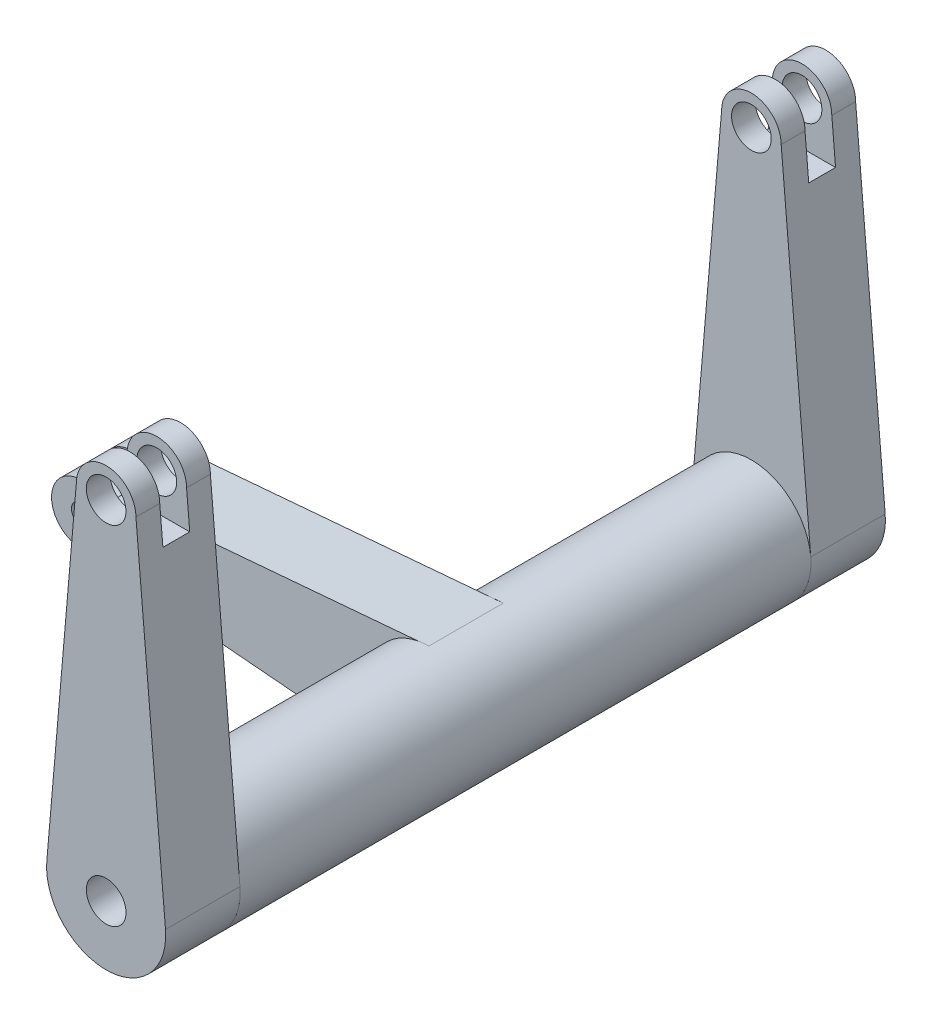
SolidWorks part; units mm, degrees
ref_plane "Front Plane" through (0, 0, 0) normal (0, 0, 1) x (1, 0, 0)
ref_plane "Top Plane" through (0, 0, 0) normal (0, 1, 0) x (1, 0, 0)
ref_plane "Right Plane" through (0, 0, 0) normal (1, 0, 0) x (0, 0, -1)
sketch "Sketch1" plane through (0, 0, 0) normal (0, 0, 1) x (1, 0, 0)
  line L0 (0, -170.9398) -> (88.9, -170.9398) construction
  line L1 (88.9, -155.6998) -> (88.9, -186.1798) construction
  line L2 (0, -163.3198) -> (88.9, -155.6998)
  line L3 (0, -178.5598) -> (88.9, -186.1798)
  circle A0 centre (0, -170.9398) radius 2.54
  arc A1 (0, -163.3198) -> (0, -178.5598) centre (0, -170.9398) ccw
  arc A2 (88.9, -186.1798) -> (88.9, -155.6998) centre (88.9, -170.9398) ccw
  dimension "D2" = 15.24
  dimension "D3" = 5.08
  dimension "D4" = 88.9
  dimension "D1" = 15.24
extrude "Extrude1" add sketch "Sketch1" along normal mid plane 19.05
sketch "Sketch3" plane through (0, 0, 0) normal (1, 0, 0) x (0, 0, -1)
  line L0 (0, -183.4572) -> (0, -158.0572) construction
  line L1 (3.429, -158.0572) -> (-3.429, -158.0572)
  line L2 (-3.429, -158.0572) -> (-3.429, -183.4572)
  line L3 (-3.429, -183.4572) -> (3.429, -183.4572)
  line L4 (3.429, -183.4572) -> (3.429, -158.0572)
  dimension "D1" = 6.858
  dimension "D2" = 25.4
extrude "Cut-Extrude1" cut sketch "Sketch3" against normal blind 19.05 and the other way blind 6.35
sketch "Sketch4" plane through (0, 0, 9.525) normal (0, 0, 1) x (1, 0, 0)
  circle A0 centre (88.9, -170.9398) radius 15.24
  dimension "D1" = 30.48
extrude "Extrude2" add sketch "Sketch4" along normal blind 63.5
sketch "Sketch5" plane through (0, 0, -9.525) normal (0, 0, -1) x (-1, 0, 0)
  circle A0 centre (-88.9, -170.9398) radius 15.24
  dimension "D1" = 30.48
extrude "Extrude3" add sketch "Sketch5" along normal blind 63.5
sketch "Sketch6" plane through (0, 0, 0) normal (0, 0, 1) x (1, 0, 0)
  line L0 (81.28, -82.0398) -> (73.7167, -169.6287)
  line L1 (96.52, -82.0398) -> (104.0833, -169.6287)
  arc A0 (73.7167, -169.6287) -> (104.0833, -169.6287) centre (88.9, -170.9398) ccw
  arc A1 (96.52, -82.0398) -> (81.28, -82.0398) centre (88.9, -82.0398) ccw
sketch "Sketch7" plane through (0, 0, 73.025) normal (0, 0, 1) x (1, 0, 0)
  line L2 (81.28, -82.0398) -> (73.7167, -169.6287)
  line L3 (104.0833, -169.6287) -> (96.52, -82.0398)
  line L4 (81.28, -82.0398) -> (73.7167, -169.6287)
  line L5 (104.0833, -169.6287) -> (96.52, -82.0398)
  arc A2 (73.7167, -169.6287) -> (104.0833, -169.6287) centre (88.9, -170.9398) ccw
  arc A3 (96.52, -82.0398) -> (81.28, -82.0398) centre (88.9, -82.0398) ccw
  arc A4 (73.7167, -169.6287) -> (104.0833, -169.6287) centre (88.9, -170.9398) ccw
  arc A5 (96.52, -82.0398) -> (81.28, -82.0398) centre (88.9, -82.0398) ccw
  dimension "D1" = 0
extrude "Extrude4" add sketch "Sketch7" along normal blind 19.05
sketch "Sketch8" plane through (0, 0, -73.025) normal (0, 0, -1) x (-1, 0, 0)
  line L2 (-73.7167, -169.6287) -> (-81.28, -82.0398)
  line L3 (-96.52, -82.0398) -> (-104.0833, -169.6287)
  line L4 (-73.7167, -169.6287) -> (-81.28, -82.0398)
  line L5 (-96.52, -82.0398) -> (-104.0833, -169.6287)
  arc A2 (-104.0833, -169.6287) -> (-73.7167, -169.6287) centre (-88.9, -170.9398) ccw
  arc A3 (-81.28, -82.0398) -> (-96.52, -82.0398) centre (-88.9, -82.0398) ccw
  arc A4 (-104.0833, -169.6287) -> (-73.7167, -169.6287) centre (-88.9, -170.9398) ccw
  arc A5 (-81.28, -82.0398) -> (-96.52, -82.0398) centre (-88.9, -82.0398) ccw
  dimension "D1" = 0
extrude "Extrude5" add sketch "Sketch8" along normal blind 19.05
sketch "Sketch9" plane through (0, 0, -92.075) normal (0, 0, -1) x (-1, 0, 0)
  circle A0 centre (-88.9, -82.0398) radius 5.08
  dimension "D1" = 10.16
extrude "Extrude6" cut sketch "Sketch9" against normal through all
sketch "Sketch10" plane through (0, 0, -92.075) normal (0, 0, -1) x (-1, 0, 0)
  circle A0 centre (-88.9, -170.9398) radius 5.08
  dimension "D1" = 10.16
extrude "Extrude7" cut sketch "Sketch10" against normal through all
sketch "Sketch11" plane through (0, 0, 0) normal (1, 0, 0) x (0, 0, -1)
  line L0 (-82.55, -55.3362) -> (-82.55, -113.9638) construction
  line L1 (-85.979, -65.976) -> (-79.121, -65.976)
  line L2 (-85.979, -65.976) -> (-85.979, -91.376)
  line L3 (-85.979, -91.376) -> (-79.121, -91.376)
  line L4 (-79.121, -65.976) -> (-79.121, -91.376)
  line L5 (79.121, -67.7069) -> (85.979, -67.7069)
  line L6 (79.121, -67.7069) -> (79.121, -93.1069)
  line L7 (79.121, -93.1069) -> (85.979, -93.1069)
  line L8 (85.979, -67.7069) -> (85.979, -93.1069)
  line L9 (-82.55, -82.0398) -> (-82.55, -40.1359) construction
  line L10 (-92.075, -82.0398) -> (-73.025, -82.0398) construction
  line L11 (82.55, -74.4198) -> (82.55, -42.673) construction
  line L13 (92.075, -74.4198) -> (73.025, -74.4198) construction
  dimension "D1" = 6.858
  dimension "D2" = 6.858
  dimension "D3" = 25.4
  dimension "D4" = 25.4
extrude "Extrude9" cut sketch "Sketch11" along normal through all
